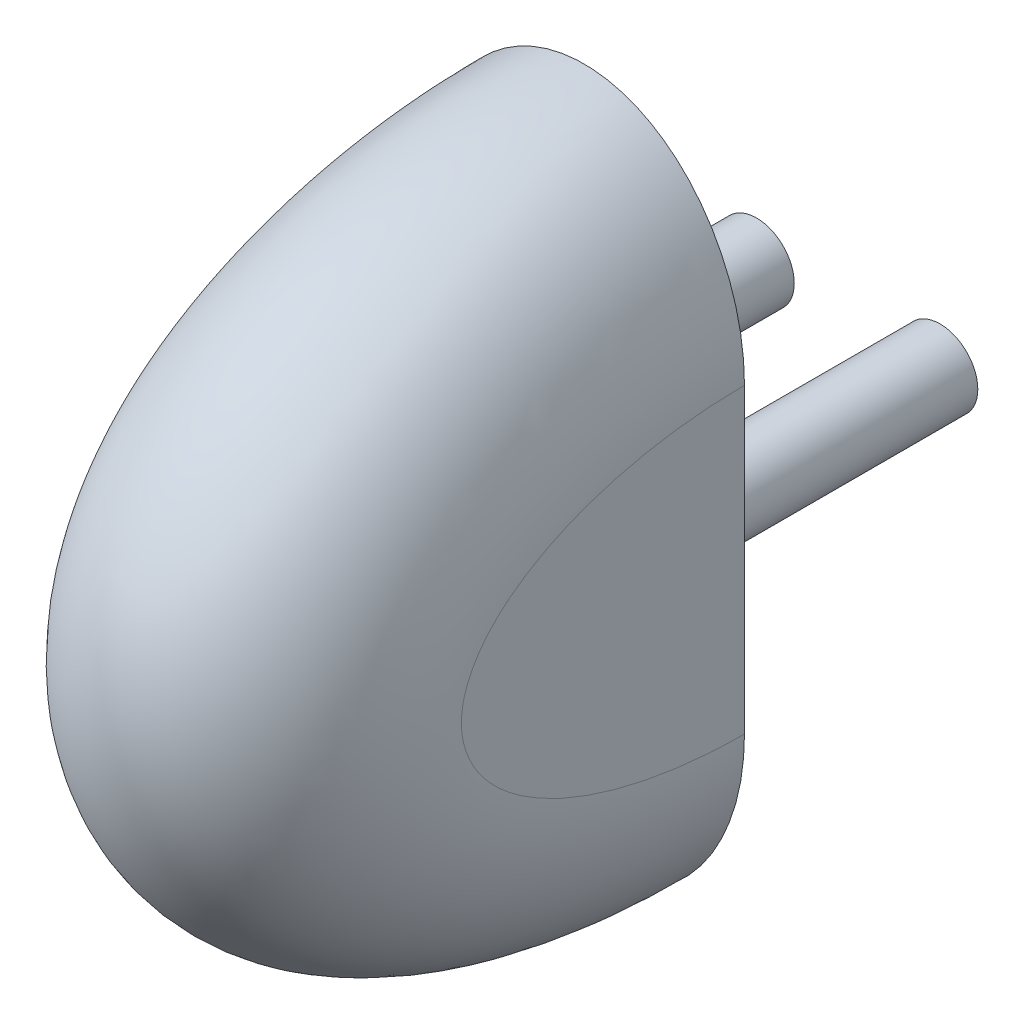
SolidWorks part; units mm, degrees
ref_plane "Front Plane" through (0, 0, 0) normal (0, 0, 1) x (1, 0, 0)
ref_plane "Top Plane" through (0, 0, 0) normal (0, 1, 0) x (1, 0, 0)
ref_plane "Right Plane" through (0, 0, 0) normal (1, 0, 0) x (0, 0, -1)
sketch "Sketch4" plane through (0, 0, 0) normal (0, 0, 1) x (1, 0, 0)
  line L1 (-8.5, 0) -> (8.5, 0)
  ellipse E0 centre (0, 0) end of major axis (0, 10.5) minor radius 8.5 (8.5, 0) -> (-8.5, 0) ccw
  dimension "D2" = 8.5
sketch "Sketch5" plane through (0, 0, 0) normal (1, 0, 0) x (0, 0, -1)
  ellipse E0 centre (0, -8) end of major axis (-15, -8) minor radius 8 (0, 0) -> (0, -16) ccw
  dimension "D1" = 16
sweep "Sweep1" add profiles "Sketch4" path "Sketch5"
sketch "Sketch6" plane through (0, 0, 0) normal (0, 0, -1) x (-1, 0, 0)
  line L0 (-8.5, -16) -> (-8.5, 0)
  line L1 (-8.5, 0) -> (8.5, 0)
  line L2 (8.5, 0) -> (8.5, -16)
  line L3 (8.5, -16) -> (-8.5, -16)
extrude "Boss-Extrude1" add sketch "Sketch6" against normal up to body
sketch "Sketch7" plane through (0, 0, 0) normal (0, 0, -1) x (-1, 0, 0)
  ellipse E0 centre (0, 0) end of major axis (0, 6.0789) minor radius 4.9211
sketch "Sketch8" plane through (0, 0, 0) normal (1, 0, 0) x (0, 0, -1)
  line L1 (0, 0) -> (-7, 0)
  line L2 (0, -6.0789) -> (0, 6.0789) construction
  line L3 (0, -16) -> (-7, -16)
  arc A1 (-7, 0) -> (-7, -16) centre (-7, -8) ccw
sweep "Cut-Sweep1" cut profiles "Sketch7" path "Sketch8"
sketch "Sketch9" plane through (0, 0, 0) normal (0, 0, -1) x (-1, 0, 0)
  circle A0 centre (-4.8631, -8) radius 2
  circle A1 centre (4.8631, -8) radius 2
  dimension "D2" = 4
extrude "Boss-Extrude2" add sketch "Sketch9" along normal blind 14
